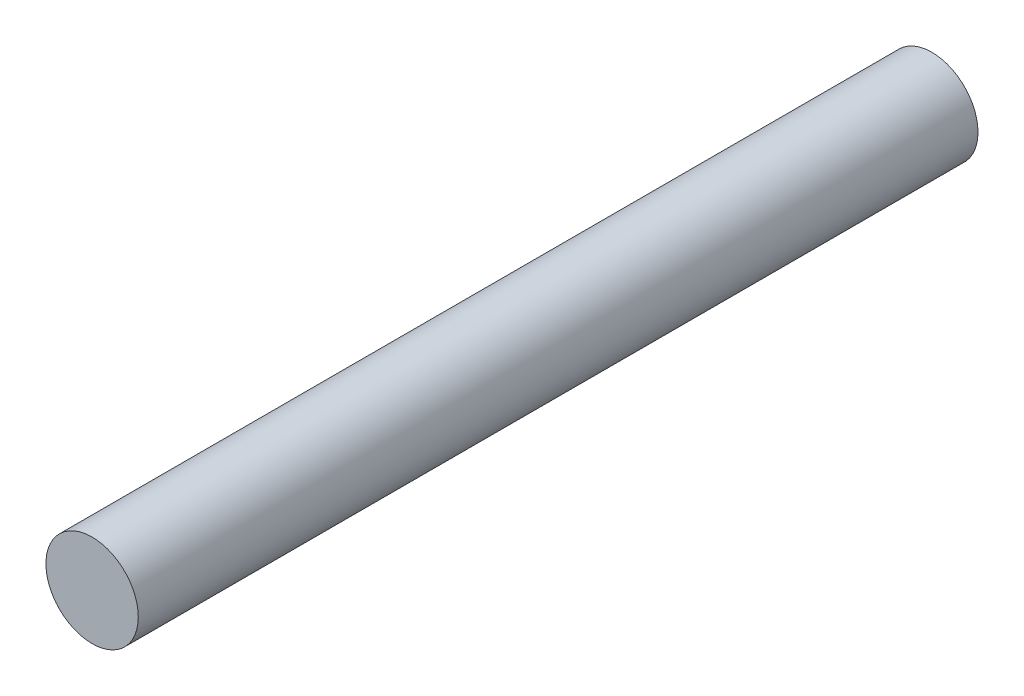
SolidWorks part; units mm, degrees
ref_plane "Front Plane" through (0, 0, 0) normal (0, 0, 1) x (1, 0, 0)
ref_plane "Top Plane" through (0, 0, 0) normal (0, 1, 0) x (1, 0, 0)
ref_plane "Right Plane" through (0, 0, 0) normal (1, 0, 0) x (0, 0, -1)
sketch "Sketch1" plane through (0, 0, 0) normal (0, 0, 1) x (1, 0, 0)
  circle A0 centre (0, 0) radius 0.55
  dimension "D1" = 1.1
extrude "Boss-Extrude1" add sketch "Sketch1" along normal mid plane 10
